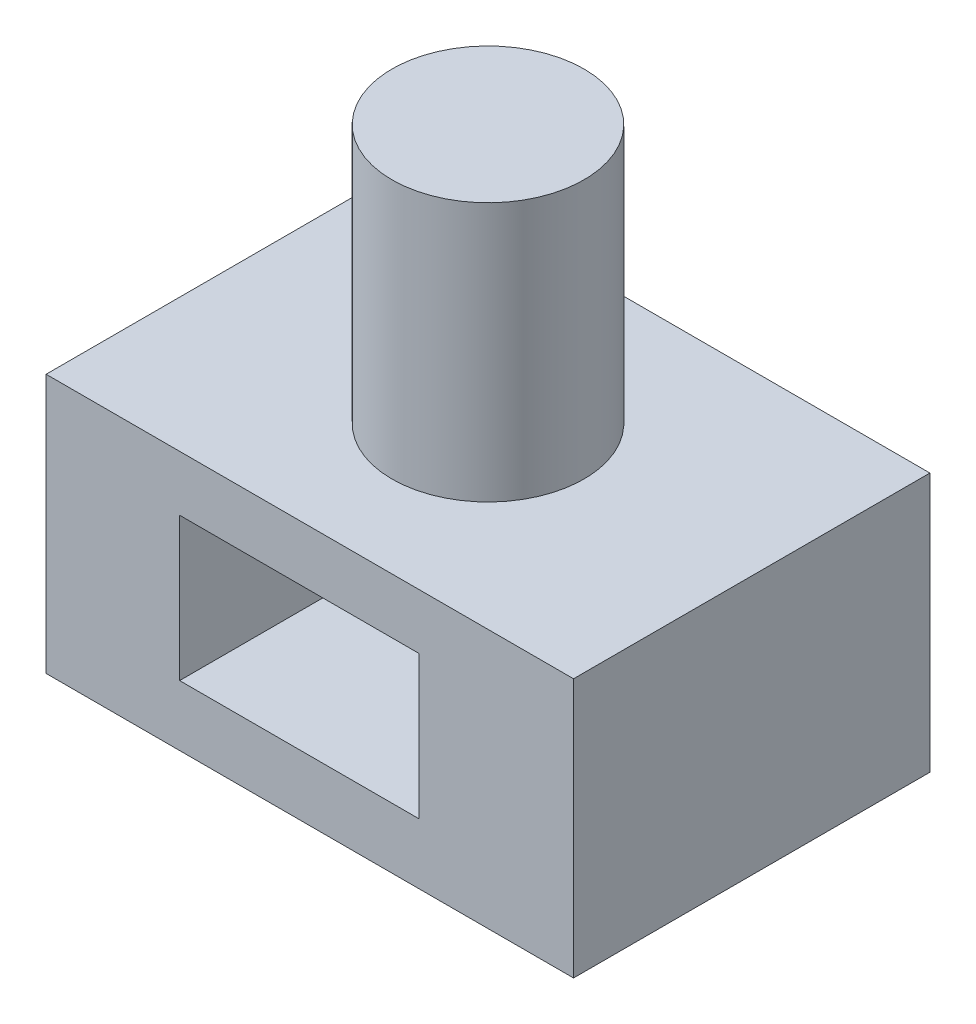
SolidWorks part; units mm, degrees
ref_plane "Front Plane" through (0, 0, 0) normal (0, 0, 1) x (1, 0, 0)
ref_plane "Top Plane" through (0, 0, 0) normal (0, 1, 0) x (1, 0, 0)
ref_plane "Right Plane" through (0, 0, 0) normal (1, 0, 0) x (0, 0, -1)
sketch "Sketch1" plane through (0, 0, 0) normal (0, 1, 0) x (1, 0, 0)
  line L1 (61.0578, -41.2514) -> (-61.0578, -41.2514)
  line L2 (61.0578, -41.2514) -> (61.0578, 41.2514)
  line L3 (61.0578, 41.2514) -> (-61.0578, 41.2514)
  line L4 (-61.0578, -41.2514) -> (-61.0578, 41.2514)
  line L5 (61.0578, -41.2514) -> (-61.0578, 41.2514) construction
  line L6 (61.0578, 41.2514) -> (-61.0578, -41.2514) construction
  point P0 (0, 0)
extrude "Boss-Extrude1" add sketch "Sketch1" along normal blind 60
sketch "Sketch2" plane through (0, 60, 0) normal (0, 1, 0) x (1, 0, 0)
  circle A0 centre (0, 0) radius 22.234
extrude "Boss-Extrude2" add sketch "Sketch2" along normal blind 60
sketch "Sketch3" plane through (0, 0, 41.2514) normal (0, 0, 1) x (1, 0, 0)
  line L1 (25.2859, 14.0331) -> (-30.1403, 14.0331)
  line L2 (25.2859, 14.0331) -> (25.2859, 47.1856)
  line L3 (25.2859, 47.1856) -> (-30.1403, 47.1856)
  line L4 (-30.1403, 14.0331) -> (-30.1403, 47.1856)
  line L5 (25.2859, 14.0331) -> (-30.1403, 47.1856) construction
  line L6 (25.2859, 47.1856) -> (-30.1403, 14.0331) construction
  point P0 (-2.4272, 30.6093)
extrude "Cut-Extrude1" cut sketch "Sketch3" against normal blind 60
